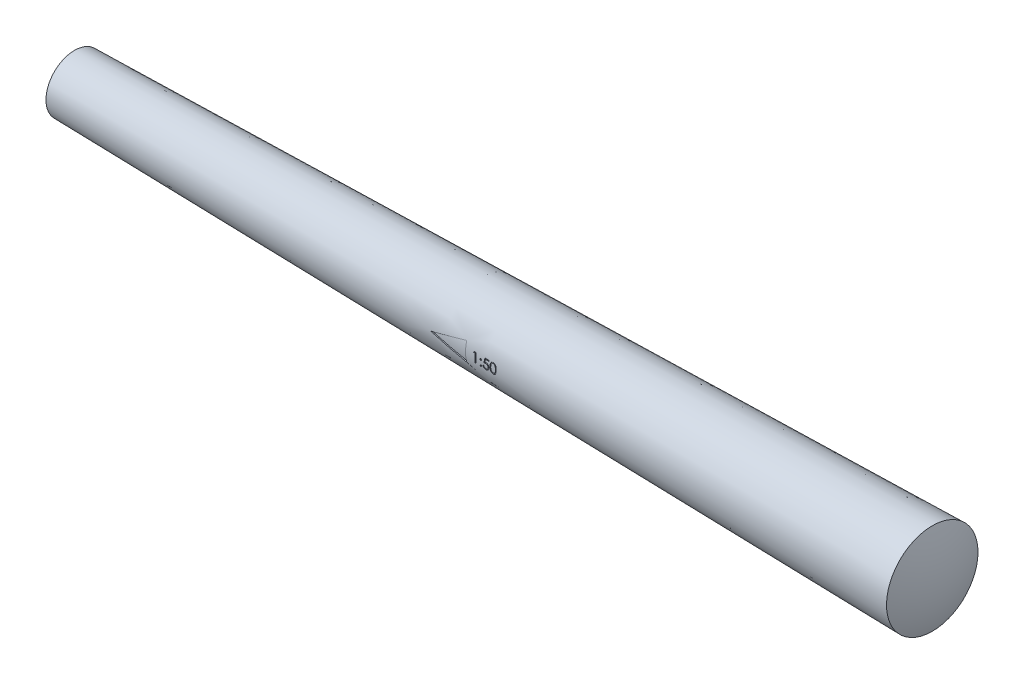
SolidWorks part; units mm, degrees
ref_plane "Front Plane" through (0, 0, 0) normal (0, 0, 1) x (1, 0, 0)
ref_plane "Top Plane" through (0, 0, 0) normal (0, 1, 0) x (1, 0, 0)
ref_plane "Right Plane" through (0, 0, 0) normal (1, 0, 0) x (0, 0, -1)
sketch "Sketch1" plane through (0, 0, 0) normal (1, 0, 0) x (0, 0, -1)
  circle A0 centre (0, 0) radius 3
  dimension "D1" = 6
extrude "Extrude1" add sketch "Sketch1" along normal mid plane 90
draft "Draft1" type of draft neutral plane draft angle 1.146 faces to draft 1 parameters "D1"=1.146
sketch "Sketch2" plane through (0, 0, 0) normal (0, 0, 1) x (1, 0, 0)
  line L0 (-45, 0) -> (-45, 3)
  line L1 (-45, 3) -> (-45, -3) construction
  line L2 (-45, 0) -> (-45.9, 0)
  line L3 (-45.9, 0) -> (-45.9, -3.9) construction
  line L4 (45, 0) -> (45, 4.8001)
  line L5 (45, -4.8001) -> (45, 4.8001) construction
  line L6 (45, 0) -> (45.9, 0)
  line L7 (45.9, 0) -> (45.9, -3.9) construction
  line L8 (-45, -3) -> (45, -4.8001) construction
  arc A0 (-45.9, 0) -> (-45, 3) centre (-40.45, 0) cw
  arc A1 (45.9, 0) -> (45, 4.8001) centre (32.6497, 0) ccw
  point P14 (0, -3.9)
revolve "Revolve1" add sketch "Sketch2" angle 360 about L2
sketch "Sketch5" plane through (0, 0, 0) normal (0, 0, 1) x (1, 0, 0)
  line L0 (0, 3.9) -> (0, -3.9) construction
  line L1 (45, 4.8001) -> (-45, 3) construction
  line L2 (-45, -3) -> (45, -4.8001) construction
ref_plane "Plane2" through (0, 0, 0) normal (-0.02, 0, 0.9998) x (0.9998, 0, 0.02)
sketch "Sketch6" plane through (0, 0, 0) normal (-0.02, 0, 0.9998) x (0.9998, 0, 0.02)
  line L0 (0, 0) -> (0, 1)
  line L1 (0, 3.9) -> (0, -3.9) construction
  line L2 (0, 1) -> (-3.7321, 0)
  line L3 (-3.7321, 0) -> (0, -1)
  line L4 (0, -1) -> (0, 0)
  line L5 (0, -0.5) -> (4, -0.5) construction
  text T0 "1:50" font "Century Gothic" height 1
  dimension "D1" = 2
  dimension "D2" = 30
  dimension "D3" = 4
wrap "Wrap2" sketch "Sketch6" wrap type deboss source sketch "Sketch6" thickness 0.1 parameters "D1"=0.1
equation "\"D2@Sketch2\" = \"D1@Sketch2\""
